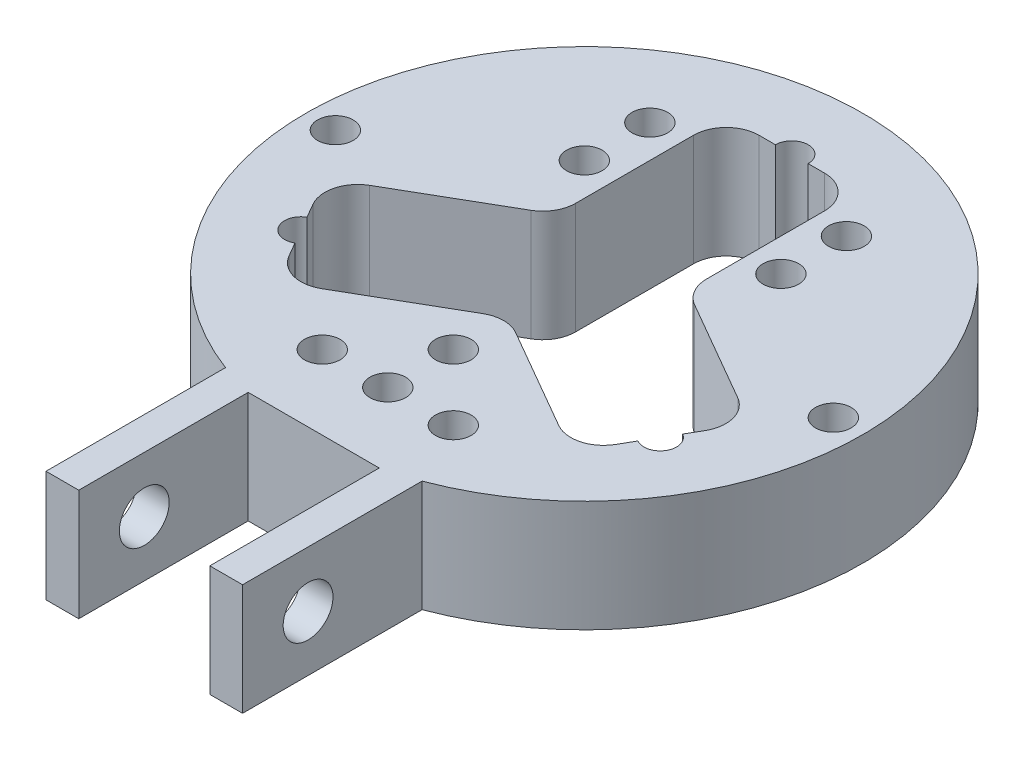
SolidWorks part; units mm, degrees
ref_plane "Front Plane" through (0, 0, 0) normal (0, 0, 1) x (1, 0, 0)
ref_plane "Top Plane" through (0, 0, 0) normal (0, 1, 0) x (1, 0, 0)
ref_plane "Right Plane" through (0, 0, 0) normal (1, 0, 0) x (0, 0, -1)
sketch "Sketch1" plane through (0, 0, 0) normal (0, 1, 0) x (1, 0, 0)
  line L0 (0, 0) -> (0, -26.2298) construction
  line L1 (-6.35, -26.2298) -> (6.35, -26.2298)
  line L2 (-6.35, -26.2298) -> (-6.35, -42.6497)
  line L3 (6.35, -26.2298) -> (6.35, -42.6497)
  line L4 (0, 0) -> (0, 20.1043) construction
  line L5 (0, 0) -> (-17.4108, -10.0521) construction
  line L6 (0, 0) -> (17.4108, -10.0521) construction
  line L7 (-3.175, 20.1043) -> (-1.5875, 20.1043)
  line L8 (-18.9983, -7.3025) -> (-18.2046, -8.6773)
  line L9 (18.9983, -7.3025) -> (18.2046, -8.6773)
  line L10 (17.8362, -2.9654) -> (7.9375, 2.7496)
  line L11 (6.35, 5.4993) -> (6.35, 16.9293)
  line L12 (-6.35, 16.9293) -> (-6.35, 5.4993)
  line L13 (-7.9375, 2.7496) -> (-17.8362, -2.9654)
  line L14 (-11.4862, -13.9639) -> (-1.5875, -8.2489)
  line L15 (1.5875, -8.2489) -> (11.4862, -13.9639)
  line L16 (1.5875, 20.1043) -> (3.175, 20.1043)
  line L17 (16.6171, -11.4269) -> (15.8233, -12.8018)
  line L18 (-16.6171, -11.4269) -> (-15.8233, -12.8018)
  line L19 (-9.525, -25.2507) -> (-9.525, -42.6497)
  line L20 (-9.525, -42.6497) -> (-6.35, -42.6497)
  line L22 (9.525, -25.2507) -> (9.525, -42.6497)
  line L23 (9.525, -42.6497) -> (6.35, -42.6497)
  arc A0 (9.525, -25.2507) -> (-9.525, -25.2507) centre (0, 0) ccw
  arc A1 (1.5875, -8.2489) -> (-1.5875, -8.2489) centre (0, -10.9985) ccw
  arc A2 (7.9375, 2.7496) -> (6.35, 5.4993) centre (9.525, 5.4993) cw
  arc A3 (-7.9375, 2.7496) -> (-6.35, 5.4993) centre (-9.525, 5.4993) ccw
  arc A4 (-18.9983, -7.3025) -> (-17.8362, -2.9654) centre (-16.2487, -5.715) cw
  arc A5 (-15.8233, -12.8018) -> (-11.4862, -13.9639) centre (-13.0737, -11.2143) ccw
  arc A6 (15.8233, -12.8018) -> (11.4862, -13.9639) centre (13.0737, -11.2143) cw
  arc A7 (18.9983, -7.3025) -> (17.8362, -2.9654) centre (16.2487, -5.715) ccw
  arc A8 (6.35, 16.9293) -> (3.175, 20.1043) centre (3.175, 16.9293) ccw
  arc A9 (-6.35, 16.9293) -> (-3.175, 20.1043) centre (-3.175, 16.9293) cw
  arc A10 (1.5875, 20.1043) -> (-1.5875, 20.1043) centre (0, 20.1043) ccw
  arc A11 (16.6171, -11.4269) -> (18.2046, -8.6773) centre (17.4108, -10.0521) ccw
  arc A12 (-18.2046, -8.6773) -> (-16.6171, -11.4269) centre (-17.4108, -10.0521) ccw
  point P21 (0, -7.3323)
  point P28 (-20.5858, -4.5529)
  point P31 (-14.2358, -15.5514)
  point P34 (14.2358, -15.5514)
  point P37 (20.5858, -4.5529)
  point P40 (6.35, 20.1043)
  point P43 (-6.35, 20.1043)
  dimension "D1" = 53.975
  dimension "D15" = 3.175
  dimension "D16" = 3.175
  dimension "D17" = 3.175
  dimension "D18" = 3.175
  dimension "D3" = 16.4199
  dimension "D4" = 12.7
  dimension "D5" = 120
  dimension "D6" = 120
  dimension "D7" = 12.7
  dimension "D8" = 6.35
  dimension "D9" = 12.7
  dimension "D10" = 90
  dimension "D11" = 6.35
  dimension "D12" = 90
  dimension "D13" = 12.7
  dimension "D14" = 6.35
  dimension "D19" = 11.43
  dimension "D20" = 11.43
  dimension "D21" = 11.43
  dimension "D22" = 11.43
  dimension "D23" = 17.399
  dimension "D24" = 17.399
  dimension "D25" = 3.175
extrude "Boss-Extrude1" add sketch "Sketch1" along normal blind 10.795
sketch "Sketch3" plane through (0, 10.795, 0) normal (0, 1, 0) x (1, 0, 0)
  line L0 (24.3763, 0) -> (-22.2781, 0) construction
  line L1 (3.1657, -19.05) -> (-3.1657, -19.05) construction
  point P0 (-9.525, 9.525)
  point P1 (9.525, 9.525)
  point P2 (0, -19.05)
  point P3 (-9.525, 15.875)
  point P5 (9.525, 15.875)
  point P6 (24.13, 0)
  point P8 (-24.13, 0)
  point P10 (0, -12.7)
  point P11 (6.35, -19.05)
  point P13 (-6.35, -19.05)
  point P14 (0, -25.4)
  dimension "D1" = 19.05
  dimension "D2" = 9.525
  dimension "D3" = 9.525
  dimension "D4" = 19.05
  dimension "D5" = 9.525
  dimension "D6" = 9.525
  dimension "D7" = 6.35
  dimension "D8" = 6.35
  dimension "D9" = 6.35
  dimension "D10" = 6.35
  dimension "D11" = 24.13
  dimension "D12" = 24.13
  dimension "D13" = 6.35
hole_wizard "#5 Clearance Hole1" positions "3DSketch2" profile "Sketch5" hole size "#5" standard "Ansi Inch"
sketch3d "3DSketch2"
  point P0 (-9.525, 10.795, -9.525)
  point P3 (9.525, 10.795, -9.525)
  point P6 (0, 10.795, 19.05)
  point P10 (-9.525, 10.795, -15.875)
  point P13 (9.525, 10.795, -15.875)
  point P16 (24.13, 10.795, 0)
  point P22 (-24.13, 10.795, 0)
  point P25 (-6.35, 10.795, 19.05)
  point P28 (0, 10.795, 12.7)
  point P31 (6.35, 10.795, 19.05)
sketch "Sketch5" plane through (-9.525, 10.795, -9.525) normal (1, 0, 0) x (0, 0, 1)
  line L0 (0, 0) -> (0, 20.0878)
  line L1 (0, 20.0878) -> (1.7272, 19.05)
  line L2 (1.7272, 19.05) -> (1.7272, 0)
  line L5 (1.7272, 0) -> (0, 0)
  line L10 (0, 20.0878) -> (-1.7272, 19.05) construction
  line L11 (0, -6.35) -> (0, 107.95) construction
  dimension "Hole Dia." = 3.4544
  dimension "Hole Depth" = 19.05
  dimension "Drill Angle" = 118
sketch "Sketch6" plane through (9.525, 0, 0) normal (1, 0, 0) x (0, 0, -1)
  line L0 (-42.6497, 10.795) -> (-42.6497, 0) construction
  line L1 (-42.6497, 10.795) -> (-25.2507, 10.795) construction
  circle A0 centre (-36.2997, 5.3975) radius 2.413
  point P2 (-42.6497, 5.3975)
  dimension "D1" = 4.826
  dimension "D2" = 6.35
  dimension "D3" = 5.3975
extrude "Cut-Extrude1" cut sketch "Sketch6" against normal through all
